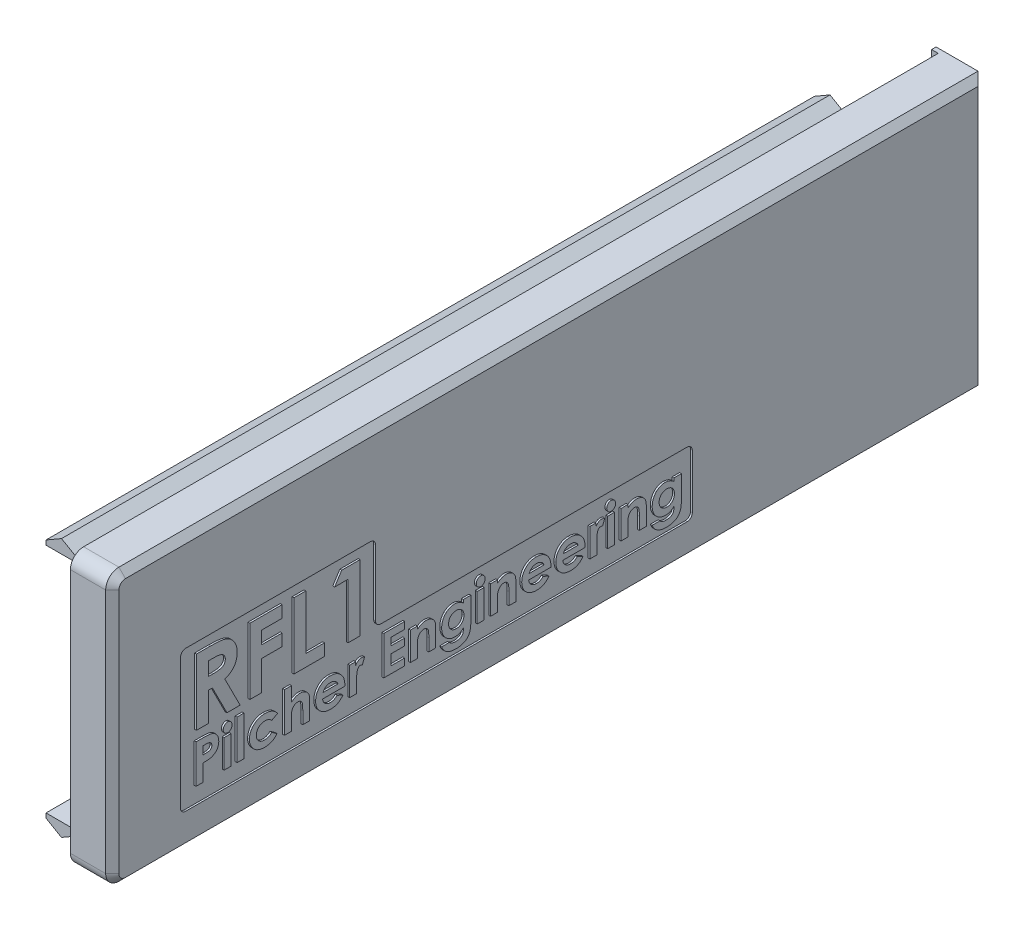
SolidWorks part; units mm, degrees
ref_plane "Front Plane" through (0, 0, 0) normal (0, 0, 1) x (1, 0, 0)
ref_plane "Top Plane" through (0, 0, 0) normal (0, 1, 0) x (1, 0, 0)
ref_plane "Right Plane" through (0, 0, 0) normal (1, 0, 0) x (0, 0, -1)
sketch "Sketch1" plane through (0, 0, 0) normal (1, 0, 0) x (0, 0, -1)
  line L0 (-1.02, 52.28) -> (-165.1, 52.28) construction
  line L1 (-167.64, 52.28) -> (0, 52.28)
  line L2 (-167.64, 52.28) -> (-167.64, 0)
  line L4 (-167.64, 0) -> (0, 0)
  line L5 (0, 52.28) -> (0, 0)
  line L6 (-167.64, 49.74) -> (-167.64, 2.54) construction
extrude "Boss-Extrude1" add sketch "Sketch1" along normal blind 1.7
fillet "Fillet1" radius 2.54 2 edges at (0.85, 0, 167.64) (0.85, 52.28, 167.64)
chamfer "Chamfer3" distance 1.27 angle 45 6 edges at (1.7, 51.5361, 166.8961) (1.7, 52.28, 82.55) (1.7, 26.14, 0) (1.7, 0, 82.55) (1.7, 0.7439, 166.8961) (1.7, 26.14, 167.64)
sketch "Sketch3" plane through (0, 0, 0) normal (-1, 0, 0) x (0, 0, 1)
  line L0 (0, 52.28) -> (0, 0)
  line L1 (0, 0) -> (165.1, 0)
  line L2 (167.64, 2.54) -> (167.64, 49.74)
  line L3 (165.1, 52.28) -> (0, 52.28)
  arc A0 (165.1, 0) -> (167.64, 2.54) centre (165.1, 2.54) ccw
  arc A1 (167.64, 49.74) -> (165.1, 52.28) centre (165.1, 49.74) ccw
extrude "Extrude-Thin1" add sketch "Sketch3" along normal blind 6.35 thin
sketch "Sketch2" plane through (1.7, 0, 0) normal (1, 0, 0) x (0, 0, -1)
  line L0 (-117.0511, 18.9308) -> (-117.0511, 33.6262) construction
  line L3 (-117.0511, 33.6262) -> (-154.532, 33.6262) construction
  line L4 (-154.532, 33.6262) -> (-154.532, 6.5076) construction
  line L5 (-154.532, 6.5076) -> (-56.1722, 6.5076) construction
  line L6 (-56.1722, 6.5076) -> (-56.1722, 18.9308) construction
  line L7 (-56.1722, 18.9308) -> (-117.0511, 18.9308) construction
  text T0 "RFL1" font "Century Gothic" height in points 48
  text T1 "Pilcher Engineering" font "Century Gothic" height in points 28
sketch "Sketch5" plane through (1.7, 0, 0) normal (1, 0, 0) x (0, 0, -1)
  line L0 (-154.532, 33.6262) -> (-117.0511, 33.6262)
  line L1 (-117.0511, 33.6262) -> (-117.0511, 18.9308)
  line L2 (-117.0511, 18.9308) -> (-56.1722, 18.9308)
  line L3 (-56.1722, 18.9308) -> (-56.1722, 6.5076)
  line L4 (-56.1722, 6.5076) -> (-154.532, 6.5076)
  line L5 (-154.532, 6.5076) -> (-154.532, 33.6262)
extrude "Cut-Extrude3" cut sketch "Sketch5" against normal blind 0.35
extrude "Boss-Extrude3" add sketch "Sketch2" against normal up to next (0.35 mm away)
fillet "Fillet2" radius 1.016 6 edges at (1.525, 18.9308, 56.1722) (1.525, 6.5076, 56.1722) (1.525, 6.5076, 154.532) (1.525, 33.6262, 154.532) (1.525, 33.6262, 117.0511) (1.525, 18.9308, 117.0511)
sketch "Sketch6" plane through (0, 0, 0) normal (0, 0, -1) x (-1, 0, 0)
  line L0 (0, 49.29) -> (8.128, 49.29)
  line L2 (8.128, 49.29) -> (11.1071, 51.01)
  line L3 (11.1071, 51.01) -> (14.0863, 49.29)
  line L4 (14.0863, 49.29) -> (14.0863, 48.42)
  line L5 (14.0863, 48.42) -> (0, 48.42)
  line L6 (0, 48.42) -> (0, 49.29)
  line L7 (14.0863, 49.29) -> (8.128, 49.29) construction
  line L10 (0, 49.74) -> (0, 2.54) construction
  line L11 (6.35, 49.74) -> (0, 49.74) construction
  point P4 (11.3071, 51.01)
  point P9 (11.1071, 49.29)
  dimension "D1" = 8.128
  dimension "D2" = 120
  dimension "D3" = 0.87
  dimension "D4" = 0.45
extrude "Boss-Extrude4" add sketch "Sketch6" against normal offset from surface (161.544 mm away) 0.508 from offset 3.048
ref_plane "Plane1" through (0, 26.14, 0) normal (0, 1, 0) x (1, 0, 0)
mirror "Mirror1" about plane through (0, 26.14, 0) normal (0, 1, 0) of "Boss-Extrude4"
sketch "Sketch7" plane through (0, 0, 0) normal (-1, 0, 0) x (0, 0, 1)
  line L1 (165.1, 47.15) -> (164.23, 47.15)
  line L2 (165.1, 47.15) -> (165.1, 5.13)
  line L3 (165.1, 5.13) -> (164.23, 5.13)
  line L4 (164.23, 47.15) -> (164.23, 5.13)
  line L5 (4.4275, 26.14) -> (-4.4275, 26.14) construction
  line L6 (164.592, 3.86) -> (3.048, 3.86) construction
  line L11 (165.1, 2.54) -> (165.1, 49.74) construction
  point P4 (164.23, 26.14)
  dimension "D1" = 1.27
  dimension "D2" = 0.87
extrude "Boss-Extrude5" add sketch "Sketch7" along normal offset from surface (7.62 mm away) 1.27
sketch "Sketch8" plane through (0, 48.42, 0) normal (0, -1, 0) x (1, 0, 0)
  line L0 (0, 164.592) -> (0, 3.048) construction
  line L1 (-14.0863, 3.048) -> (0, 3.048)
  line L2 (-14.0863, 3.048) -> (-14.0863, 16.9094)
  line L3 (-14.0863, 16.9094) -> (0, 16.9094)
  line L4 (0, 3.048) -> (0, 16.9094)
  line L5 (-21.35, 16.7594) -> (-13.5068, 16.7594) construction
  dimension "D1" = 0.15
extrude "Cut-Extrude4" cut sketch "Sketch8" against normal up to next
sketch "Sketch9" plane through (0, 3.86, 0) normal (0, 1, 0) x (1, 0, 0)
  line L0 (0, -164.592) -> (0, -3.048) construction
  line L1 (-14.0863, -3.048) -> (0, -3.048)
  line L2 (-14.0863, -3.048) -> (-14.0863, -6.5)
  line L3 (-14.0863, -6.5) -> (0, -6.5)
  line L4 (0, -3.048) -> (0, -6.5)
  line L5 (-21.35, -6.35) -> (-13.5068, -6.35) construction
  dimension "D1" = 0.15
extrude "Cut-Extrude5" cut sketch "Sketch9" against normal up to next contours L2 L3 L4 L1
sketch "Sketch11" plane through (0, 52.28, 0) normal (0, 1, 0) x (1, 0, 0)
  line L0 (-7.62, -165.1) -> (-7.62, -164.23) construction
  line L1 (-6.35, 0) -> (-7.62, 0)
  line L2 (-6.35, 0) -> (-6.35, -0.87)
  line L3 (-6.35, -0.87) -> (-7.62, -0.87)
  line L4 (-7.62, 0) -> (-7.62, -0.87)
  dimension "D1" = 0.87
extrude "Boss-Extrude7" add sketch "Sketch11" against normal up to surface (52.28 mm away)
